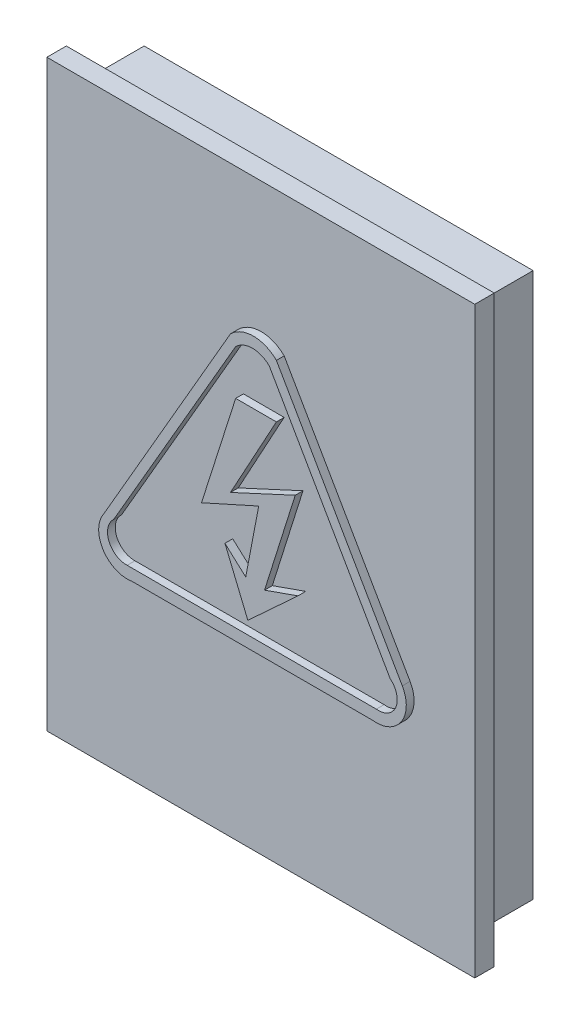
SolidWorks part; units mm, degrees
ref_plane "Alzado" through (0, 0, 0) normal (0, 0, 1) x (1, 0, 0)
ref_plane "Planta" through (0, 0, 0) normal (0, 1, 0) x (1, 0, 0)
ref_plane "Vista lateral" through (0, 0, 0) normal (1, 0, 0) x (0, 0, -1)
sketch "Croquis1" plane through (0, 0, 0) normal (0, 0, 1) x (1, 0, 0)
  line L1 (-50, 70) -> (50, 70)
  line L2 (-50, 70) -> (-50, -70)
  line L3 (-50, -70) -> (50, -70)
  line L4 (50, 70) -> (50, -70)
  line L5 (-50, 70) -> (50, -70) construction
  line L6 (-50, -70) -> (50, 70) construction
  point P0 (0, 0)
  dimension "D1" = 100
  dimension "D2" = 140
extrude "Saliente-Extruir2" add sketch "Croquis1" along normal blind 15
sketch "Croquis3" plane through (0, 0, 15) normal (0, 0, 1) x (1, 0, 0)
  line L1 (-55, 75) -> (55, 75)
  line L2 (-55, 75) -> (-55, -75)
  line L3 (-55, -75) -> (55, -75)
  line L4 (55, 75) -> (55, -75)
  line L5 (-55, 75) -> (55, -75) construction
  line L6 (-55, -75) -> (55, 75) construction
  point P0 (0, 0)
  dimension "D1" = 150
  dimension "D2" = 110
extrude "Saliente-Extruir4" add sketch "Croquis3" along normal blind 5
sketch "Croquis5" plane through (0, 0, 20) normal (0, 0, 1) x (1, 0, 0)
  line L0 (185.4487, 548.1586) -> (1052.1154, 548.1586) construction
  line L1 (-38.3423, -17.2884) -> (-5.8016, 39.013)
  line L2 (6.0006, 39.013) -> (38.371, -17.2783)
  line L3 (-31.1613, -28.7499) -> (30.6347, -28.7499)
  line L4 (-35.8066, -17.2884) -> (-4.468, 36.8468)
  line L5 (4.1708, 36.8468) -> (35.28, -17.2783)
  line L6 (-32.3633, -25.7939) -> (31.6925, -25.7939)
  line L9 (-4.468, 25.3143) -> (6.0006, 25.3143)
  line L10 (6.0006, 25.3143) -> (-5.8016, 3.7104)
  line L11 (-5.8016, 3.7104) -> (10.8432, 11.4018)
  line L12 (10.8432, 11.4018) -> (2.953, -13.6712)
  line L13 (11.549, -10.646) -> (2.953, -13.6712)
  line L14 (-7.2267, -8.3267) -> (-1.3386, -22.5362)
  line L15 (-1.8811, -13.1642) -> (-7.2267, -8.3267)
  line L16 (-1.3386, -22.5362) -> (11.549, -10.646)
  line L17 (-1.8811, -13.1642) -> (1.4578, 4.303)
  line L18 (1.4578, 4.303) -> (-13.252, -2.3172)
  line L19 (-13.252, -2.3172) -> (-4.468, 25.3143)
  arc A0 (30.6347, -28.7499) -> (38.371, -17.2783) centre (31.6925, -21.1188) ccw
  arc A1 (-31.1613, -28.7499) -> (-38.3423, -17.2884) centre (-32.3633, -21.5227) cw
  arc A2 (-5.8016, 39.013) -> (6.0006, 39.013) centre (0.0995, 33.112) cw
  arc A3 (-35.8066, -17.2884) -> (-32.3633, -25.7939) centre (-32.5355, -20.9139) ccw
  arc A4 (35.28, -17.2783) -> (31.6925, -25.7939) centre (32.2623, -21.0205) cw
  arc A5 (-4.468, 36.8468) -> (4.1708, 36.8468) centre (-0.1486, 32.5274) cw
sketch "Croquis6" plane through (0, 0, 20) normal (0, 0, 1) x (1, 0, 0)
extrude "Saliente-Extruir6" add sketch "Croquis5" along normal blind 2 contours L19 L18 L17 L15 L14 L16 L13 L12 L11 L10 L9 | A2 L1 A1 L3 A0 L2 L4 A5 L5 A4 L6 A3
